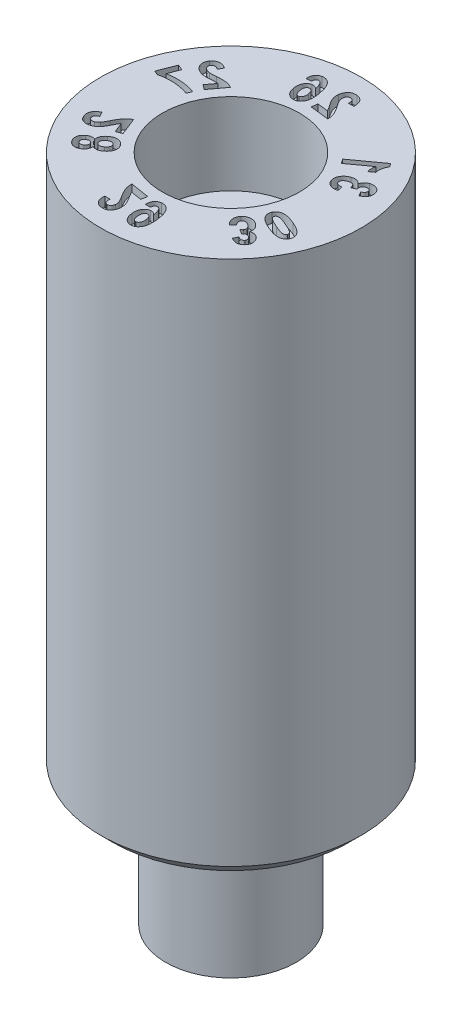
SolidWorks part; units mm, degrees
other "<M8L16-SetScrew>-<Chamfer1>" parameters "D10"=0.75
ref_plane "Front Plane" through (0, 0, 0) normal (0, 0, 1) x (1, 0, 0)
ref_plane "Top Plane" through (0, 0, 0) normal (0, 1, 0) x (1, 0, 0)
ref_plane "Right Plane" through (0, 0, 0) normal (1, 0, 0) x (0, 0, -1)
sketch "Sketch1" plane through (0, 0, 0) normal (0, 0, 1) x (1, 0, 0)
  line L0 (0, 0) -> (0, 20) construction
  line L1 (0, -8.8) -> (0, 8.8) construction
  line L2 (4, -33) -> (7.25, -33)
  line L4 (8, -32.25) -> (8, 0)
  line L5 (8, 0) -> (4.2, 0)
  line L6 (4.2, 0) -> (4.2, -5)
  line L7 (4.2, -5) -> (1.75, -5)
  line L8 (1.75, -5) -> (1.75, -23)
  line L9 (1.75, -23) -> (4, -23)
  line L10 (4, -23) -> (4, -33)
  line L11 (7.25, -33) -> (8, -32.25)
  point P6 (8, -33)
  dimension "D1" = 5
  dimension "D2" = 10
  dimension "D3" = 3.5
  dimension "D4" = 8.4
  dimension "D5" = 16
  dimension "D6" = 8
  dimension "D7" = 33
revolve "Revolve1" add sketch "Sketch1" angle 360 about L0
sketch "Sketch2" plane through (0, 0, 0) normal (0, 1, 0) x (1, 0, 0)
  line L0 (0, 0) -> (0, 8.4189) construction
  line L1 (0, 0) -> (7.291, 4.2094) construction
  line L2 (0, 0) -> (7.291, -4.2094) construction
  line L3 (0, 0) -> (0, -8.4189) construction
  line L4 (0, 0) -> (-7.291, -4.2094) construction
  line L5 (0, 0) -> (-7.291, 4.2094) construction
  arc A0 (1.2401, 4.7434) -> (2.4507, 4.2464) centre (0, 0) ccw construction
  text T0 "26   27   28   29   30   31" font "Arial Narrow" height 2.08
  point P13 (0, 0)
  point P16 (0, 0)
  point P17 (0, 0)
  point P21 (0, 0)
  dimension "D2" = 6
extrude "Cut-Extrude1" cut sketch "Sketch2" against normal blind 0.6
inserted part "M8L16-SetScrew"
move or copy body "Body-Move/Copy2" placed by mates yes
other "Distance1" parameters "D1"=8
